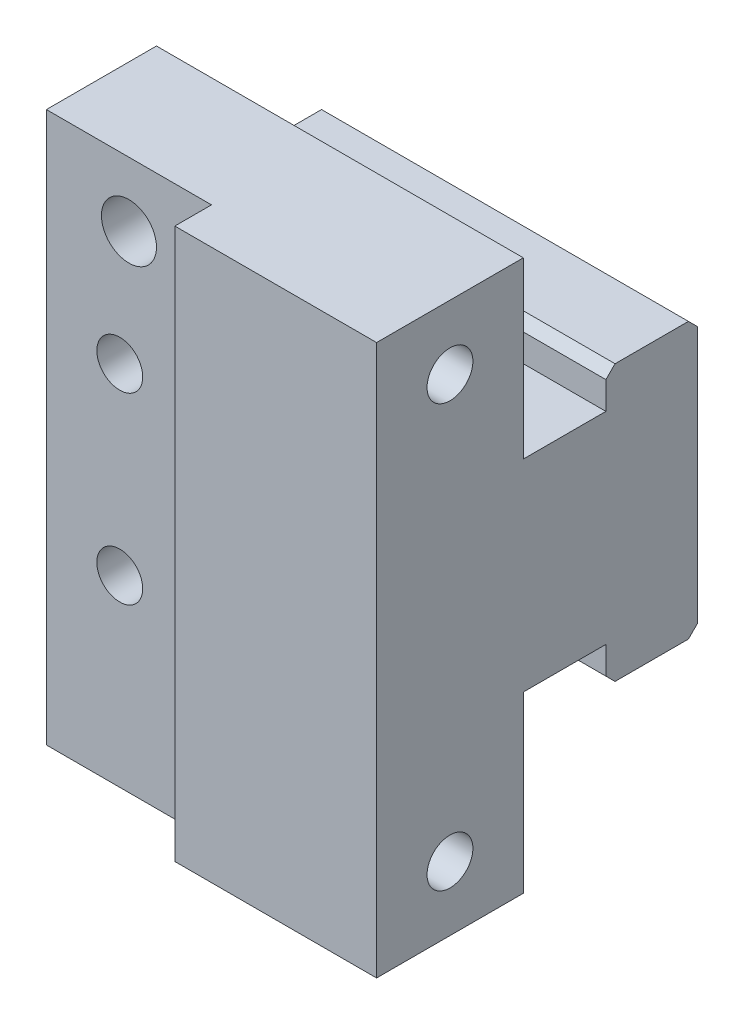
SolidWorks part; units mm, degrees
ref_plane "前基準面" through (0, 0, 0) normal (0, 0, 1) x (1, 0, 0)
ref_plane "上基準面" through (0, 0, 0) normal (0, 1, 0) x (1, 0, 0)
ref_plane "右基準面" through (0, 0, 0) normal (1, 0, 0) x (0, 0, -1)
sketch "草圖1" plane through (0, 0, 0) normal (1, 0, 0) x (0, 0, -1)
  line L0 (0, -15) -> (14.5437, -15) construction
  line L1 (0, 0) -> (8, 0)
  line L2 (0, 0) -> (0, -30)
  line L3 (0, -30) -> (8, -30)
  line L4 (17.5, -7.5) -> (17.5, -22.5)
  line L5 (12.5, -22.5) -> (17.5, -22.5)
  line L6 (8, 0) -> (8, -9.5)
  line L7 (8, -9.5) -> (12.5, -9.5)
  line L8 (12.5, -7.5) -> (12.5, -9.5)
  line L9 (12.5, -7.5) -> (17.5, -7.5)
  line L10 (12.5, -22.5) -> (12.5, -20.5)
  line L11 (8, -20.5) -> (12.5, -20.5)
  line L12 (8, -30) -> (8, -20.5)
  dimension "D1" = 30
  dimension "D2" = 8
  dimension "D3" = 17.5
  dimension "D4" = 5
  dimension "D5" = 15
  dimension "D6" = 2
extrude "伸長1" add sketch "草圖1" along normal blind 20
sketch "草圖2" plane through (0, 0, 0) normal (0, 0, 1) x (1, 0, 0)
  line L0 (20, -30) -> (0, -30) construction
  line L1 (0, 0) -> (9, 0)
  line L2 (0, 0) -> (0, -30)
  line L3 (0, -30) -> (9, -30)
  line L4 (9, 0) -> (9, -30)
  dimension "D1" = 9
extrude "除料-伸長1" cut sketch "草圖2" against normal blind 2
hole_wizard "M3x0.5 螺紋孔1" positions "草圖4" profile "草圖3" tap size "M3x0.5" standard "Ansi 公制"
sketch "草圖4" plane through (0, 0, -2) normal (0, 0, 1) x (1, 0, 0)
  line L0 (0, -15) -> (9, -15) construction
  line L1 (0, 0) -> (0, -30) construction
  line L2 (9, -30) -> (9, 0) construction
  point P0 (4, -10)
  point P11 (4, -20)
  dimension "D1" = 10
  dimension "D2" = 4
sketch "草圖3" plane through (4, -10, -2) normal (1, 0, 0) x (0, -1, 0)
  line L0 (0, 0) -> (0, 8.2511)
  line L1 (0, 8.2511) -> (1.25, 7.5)
  line L2 (1.25, 7.5) -> (1.25, 0)
  line L5 (1.25, 0) -> (0, 0)
  line L10 (0, 8.2511) -> (-1.25, 7.5) construction
  line L11 (0, -6.35) -> (0, 107.95) construction
  dimension "螺孔鑽直徑" = 2.5
  dimension "螺孔鑽深度" = 7.5
  dimension "導頭角度" = 118
hole_wizard "M3x0.5 螺紋孔2" positions "草圖6" profile "草圖5" tap size "M3x0.5" standard "Ansi 公制"
sketch "草圖6" plane through (20, 0, 0) normal (1, 0, 0) x (0, 0, -1)
  line L0 (0, -15) -> (17.5, -15) construction
  line L1 (0, 0) -> (0, -30) construction
  line L2 (17.5, -22.5) -> (17.5, -7.5) construction
  point P0 (4, -3.5)
  point P11 (4, -26.5)
  dimension "D1" = 23
  dimension "D2" = 4
sketch "草圖5" plane through (20, -3.5, -4) normal (0, 1, 0) x (0, 0, -1)
  line L0 (0, 0) -> (0, 8.2511)
  line L1 (0, 8.2511) -> (1.25, 7.5)
  line L2 (1.25, 7.5) -> (1.25, 0)
  line L5 (1.25, 0) -> (0, 0)
  line L10 (0, 8.2511) -> (-1.25, 7.5) construction
  line L11 (0, -6.35) -> (0, 107.95) construction
  dimension "螺孔鑽直徑" = 2.5
  dimension "螺孔鑽深度" = 7.5
  dimension "導頭角度" = 118
chamfer "導角1" distance 0.5 angle 45 4 edges at (10, -7.5, -17.5) (10, -7.5, -12.5) (10, -22.5, -12.5) (10, -22.5, -17.5)
hole_wizard "Ø3.0 (3) 直徑孔1" positions "草圖8" profile "草圖9" hole size "Ø3.0" standard "Ansi 公制"
sketch "草圖8" plane through (0, 0, -2) normal (0, 0, 1) x (1, 0, 0)
  line L0 (4.5, 0) -> (4.5, -30) construction
  line L1 (9, 0) -> (0, 0) construction
  line L2 (0, -30) -> (9, -30) construction
  point P0 (4.5, -3.5)
  dimension "D1" = 3.5
sketch "草圖9" plane through (4.5, -3.5, -2) normal (1, 0, 0) x (0, -1, 0)
  line L0 (0, 0) -> (0, 15.5)
  line L1 (0, 15.5) -> (1.5, 15.5)
  line L2 (1.5, 15.5) -> (1.5, 0)
  line L5 (1.5, 0) -> (0, 0)
  line L11 (0, -6.35) -> (0, 107.95) construction
  dimension "貫穿孔直徑" = 3
  dimension "貫穿孔深度" = 15.5
